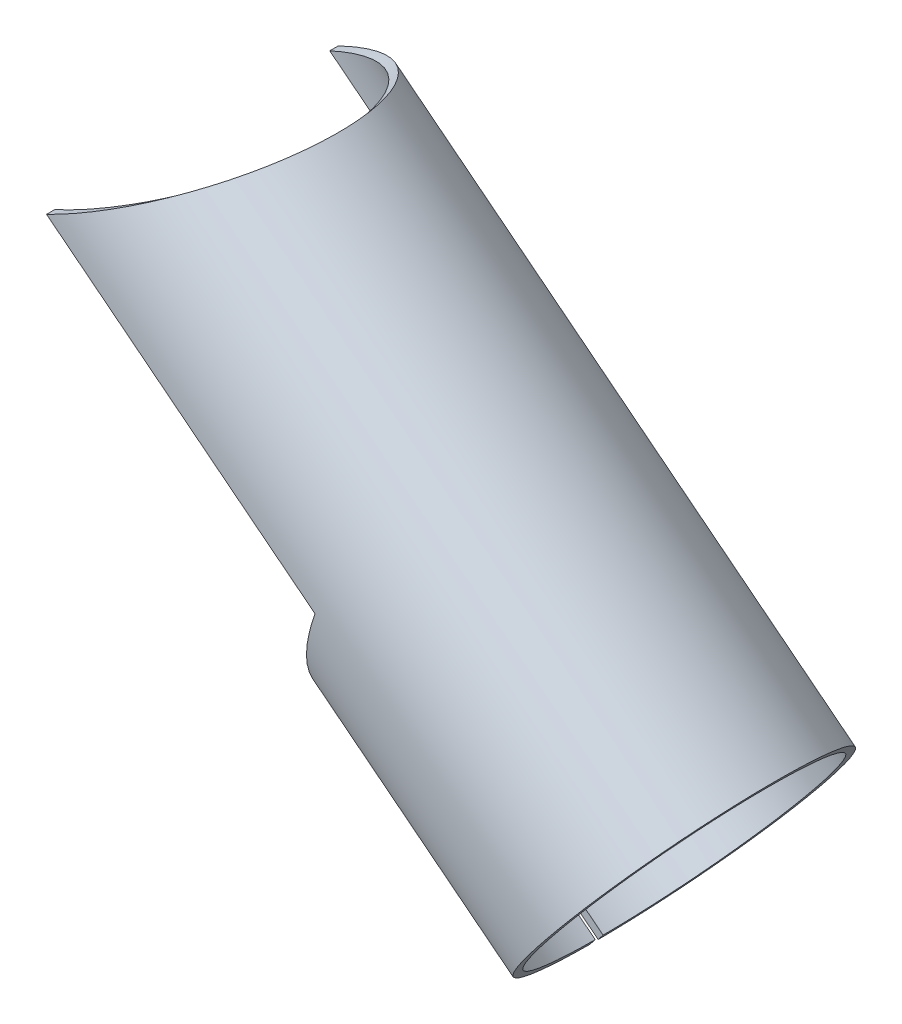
SolidWorks part; units mm, degrees
ref_plane "前视基准面" through (0, 0, 0) normal (0, 0, 1) x (1, 0, 0)
ref_plane "上视基准面" through (0, 0, 0) normal (0, 1, 0) x (1, 0, 0)
ref_plane "右视基准面" through (0, 0, 0) normal (1, 0, 0) x (0, 0, -1)
imported_body "基体零件-带补料的任意角Y形三通管-1"
sheet metal parameters "钣金1" parameters "D1"=0.7366, "厚度"=1
bend "圆角折弯1" bend radius 16.4845 bend angle 356.723 parameters "D5"=1
flatten bends "展开-折弯1"
sketch "尖角-草图1" plane through (37.1617, -51.5443, -0.5) normal (-0.6188, -0.785, -0.0286) x (0.7856, -0.6184, -0.0225)
  line L0 (15.186, -50.9867) -> (-12.8733, -51.6192) construction
  dimension "D1" = 0
process bends "加工-折弯1" parameters "D1"=0
sketch "平面-草图1" plane through (37.1617, -51.5443, -0.5) normal (-0.6188, -0.785, -0.0286) x (0.7856, -0.6184, -0.0225)
